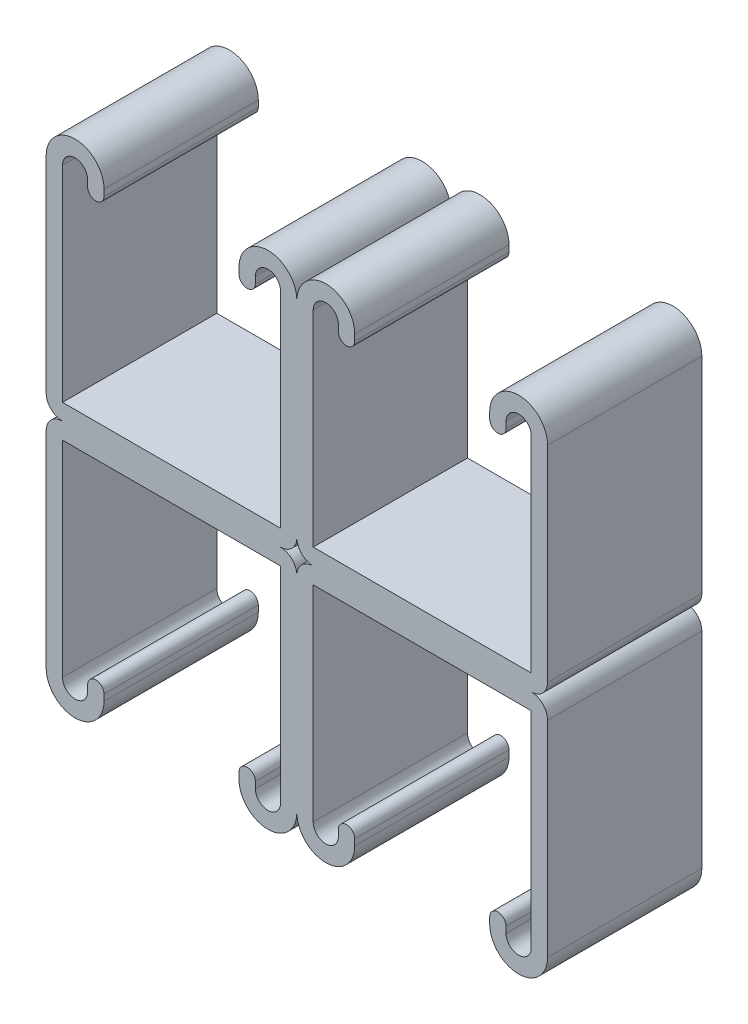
SolidWorks part; units mm, degrees
ref_plane "Plane1" through (0, 0, 0) normal (0, 0, 1) x (1, 0, 0)
ref_plane "Plane2" through (0, 0, 0) normal (0, 1, 0) x (1, 0, 0)
ref_plane "Plane3" through (0, 0, 0) normal (1, 0, 0) x (0, 0, -1)
sketch "Sketch1" plane through (0, 0, 0) normal (0, 0, 1) x (1, 0, 0)
  line L0 (0, 36.5125) -> (0, 2.6924)
  line L1 (2.6924, 0) -> (38.5826, 0)
  line L2 (41.275, 2.6924) -> (41.275, 36.5125)
  line L3 (31.75, 36.5125) -> (31.75, 35.4774)
  line L4 (9.525, 36.5125) -> (9.525, 35.4774)
  line L5 (6.8326, 36.5125) -> (6.8326, 35.4774)
  line L6 (2.6924, 36.5125) -> (2.6924, 2.6924)
  line L7 (2.6924, 2.6924) -> (38.5826, 2.6924)
  line L8 (38.5826, 2.6924) -> (38.5826, 36.5125)
  line L9 (34.4424, 36.5125) -> (34.4424, 35.4774)
  line L10 (-4.7625, 41.275) -> (46.0375, 41.275) construction
  line L11 (7.7851, 34.1313) -> (33.4899, 34.1313) construction
  arc A0 (41.275, 36.5125) -> (31.75, 36.5125) centre (36.5125, 36.5125) ccw
  arc A1 (0, 36.5125) -> (9.525, 36.5125) centre (4.7625, 36.5125) cw
  arc A2 (2.6924, 0) -> (0, 2.6924) centre (2.6924, 2.6924) cw
  arc A3 (38.5826, 0) -> (41.275, 2.6924) centre (38.5826, 2.6924) ccw
  arc A4 (2.6924, 36.5125) -> (6.8326, 36.5125) centre (4.7625, 36.5125) cw
  arc A5 (38.5826, 36.5125) -> (34.4424, 36.5125) centre (36.5125, 36.5125) ccw
  arc A6 (31.75, 35.4774) -> (34.4424, 35.4774) centre (33.0962, 35.4774) ccw
  arc A7 (9.525, 35.4774) -> (6.8326, 35.4774) centre (8.1788, 35.4774) cw
  dimension "D1" = 2.6924
  dimension "Width" = 41.275
  dimension "D6" = 9.525
  dimension "D7" = 22.225
  dimension "D9" = 7.1437
  dimension "D2" = 41.275
  dimension "gauge" = 2.6924
extrude "Base-Extrude" add sketch "Sketch1" along normal mid plane 25.4
mirror "Mirror1" about plane through (0, 0, 0) normal (1, 0, 0) of "Base-Extrude"
mirror "Mirror2" about plane through (0, 0, 0) normal (0, 1, 0) of "Base-Extrude", "Mirror1"
equation "\"D7@Sketch1\" = \"Width@Sketch1\" - 2 * \"D6@Sketch1\""
equation "\"D1@Sketch1\" = \"gauge@Sketch1\""
